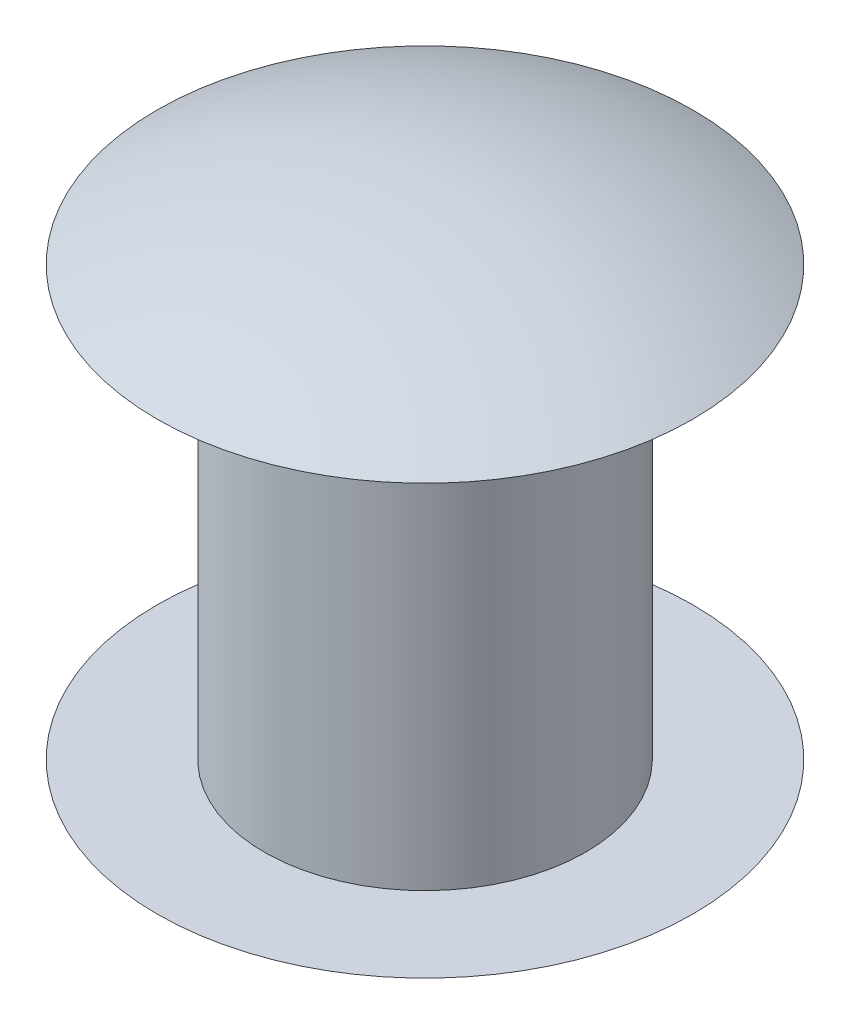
SolidWorks part; units mm, degrees
ref_plane "正面" through (0, 0, 0) normal (0, 0, 1) x (1, 0, 0)
ref_plane "平面" through (0, 0, 0) normal (0, 1, 0) x (1, 0, 0)
ref_plane "右側面" through (0, 0, 0) normal (1, 0, 0) x (0, 0, -1)
sketch "ｽｹｯﾁ1" plane through (0, 0, 0) normal (0, 0, 1) x (1, 0, 0)
  line L0 (0, 2.6) -> (0, -2.6)
  line L1 (2.5, 2) -> (1.5, 2)
  line L2 (1.5, 2) -> (1.5, -2)
  line L3 (1.5, -2) -> (2.5, -2)
  line L4 (0, 0) -> (0, 3.9633) construction
  arc A0 (0, 2.6) -> (2.5, 2) centre (0, -2.9083) cw
  arc A1 (2.5, -2) -> (0, -2.6) centre (0, 2.9083) cw
  point P2 (1.5, 0)
  dimension "D1" = 4
  dimension "D2" = 5.2
  dimension "D3" = 3
  dimension "D4" = 5
revolve "回転1" add sketch "ｽｹｯﾁ1" angle 360 about L4
